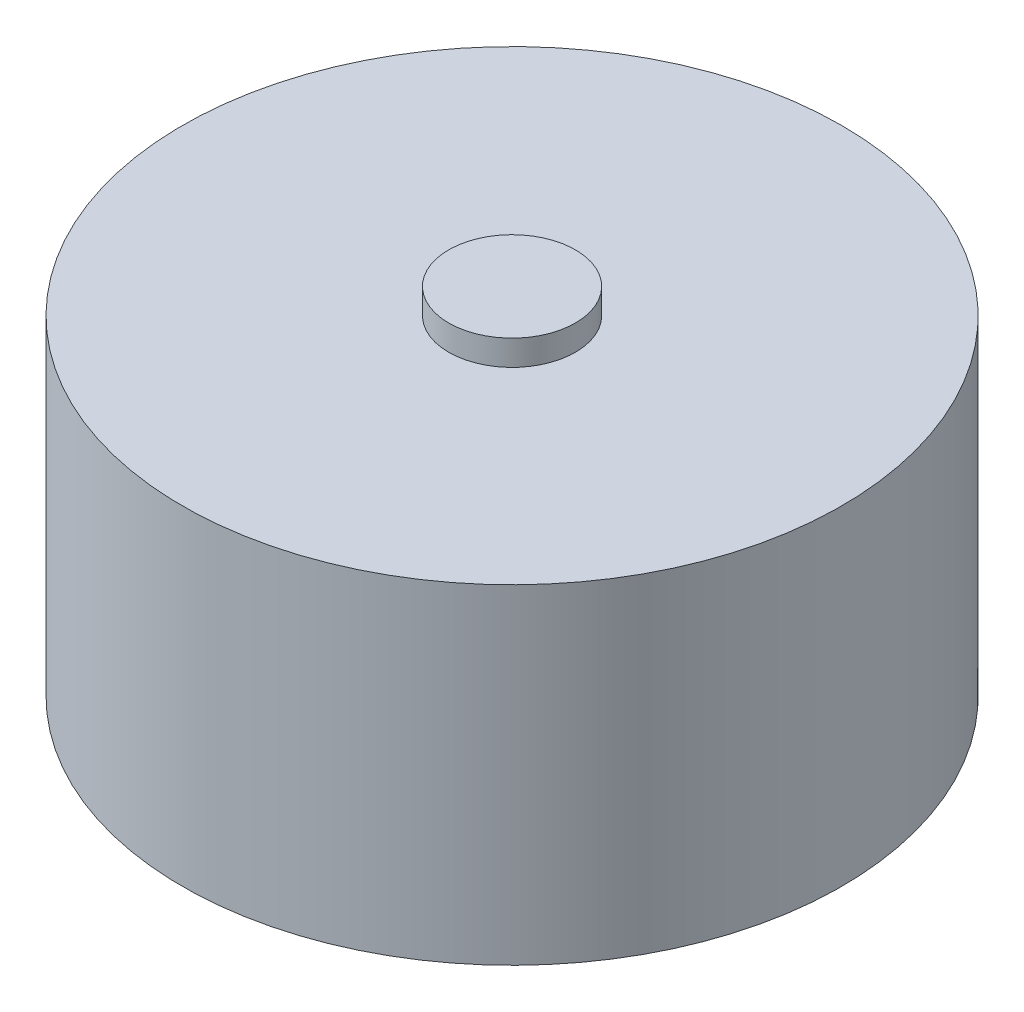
SolidWorks part; units mm, degrees
ref_plane "Front" through (0, 0, 0) normal (0, 0, 1) x (1, 0, 0)
ref_plane "Top" through (0, 0, 0) normal (0, 1, 0) x (1, 0, 0)
ref_plane "Right" through (0, 0, 0) normal (1, 0, 0) x (0, 0, -1)
sketch "Sketch1" plane through (0, 0, 0) normal (0, 1, 0) x (1, 0, 0)
  circle A0 centre (0, 0) radius 6.5
  dimension "D1" = 13
extrude "Boss-Extrude1" add sketch "Sketch1" along normal blind 6.5
sketch "Sketch2" plane through (0, 6.5, 0) normal (0, 1, 0) x (1, 0, 0)
  circle A0 centre (0, 0) radius 1.25
  dimension "D1" = 2.5
extrude "Boss-Extrude2" add sketch "Sketch2" along normal blind 0.5
